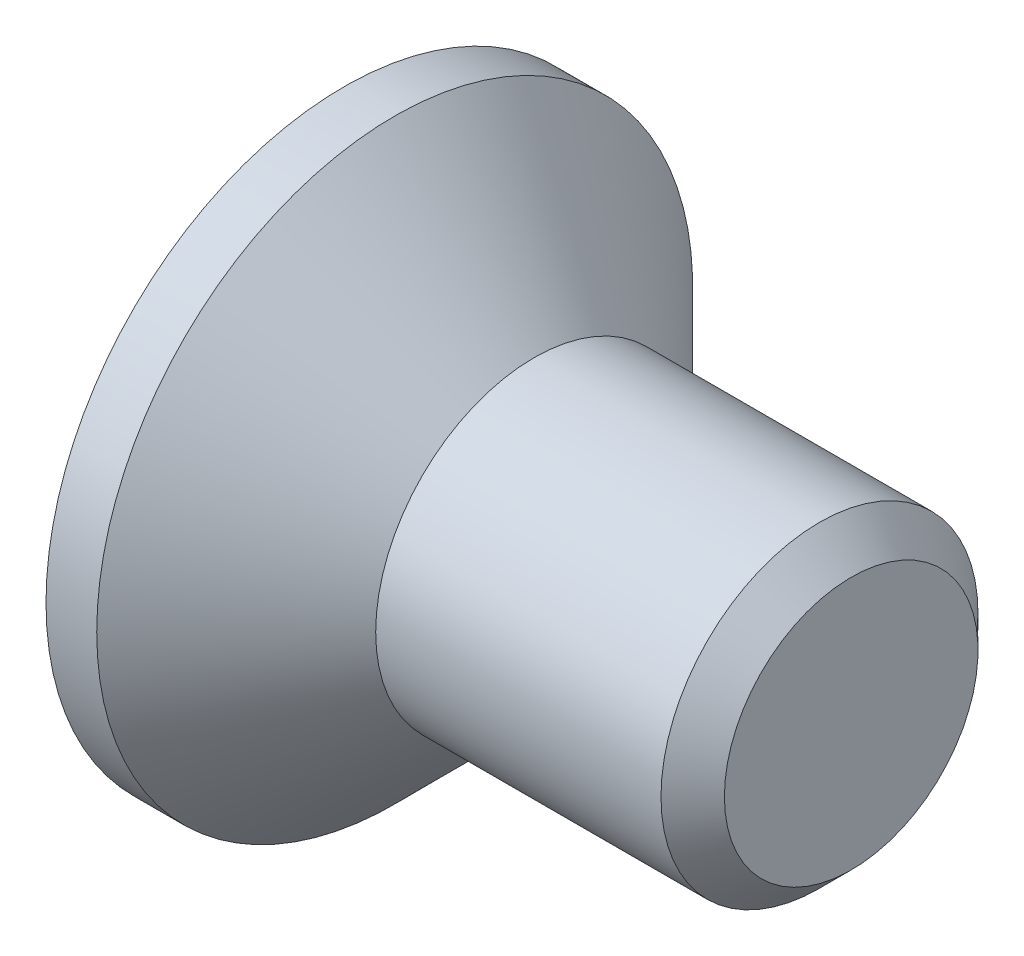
SolidWorks part; units mm, degrees
ref_plane "Front Plane" through (0, 0, 0) normal (0, 0, 1) x (1, 0, 0)
ref_plane "Top Plane" through (0, 0, 0) normal (0, 1, 0) x (1, 0, 0)
ref_plane "Right Plane" through (0, 0, 0) normal (1, 0, 0) x (0, 0, -1)
sketch "Sketch1" plane through (0, 0, 0) normal (0, 0, 1) x (1, 0, 0)
  line L1 (-1.5, 2.35) -> (-1.5, 0)
  line L2 (-1.5, 0) -> (2.5, 0)
  line L3 (2.5, 0) -> (2.5, 1.25)
  line L4 (2.5, 1.25) -> (0, 1.25)
  line L5 (-1.5, 2.35) -> (-1.1, 2.35)
  line L6 (-1.1, 2.35) -> (0, 1.25)
  dimension "D1" = 1.25
  dimension "D2" = 45
  dimension "D3" = 1.5
  dimension "D4" = 4
  dimension "D5" = 2.35
revolve "Revolve1" add sketch "Sketch1" angle 360 about L2
chamfer "Chamfer1" distance 0.25 angle 45 1 edges at (2.5, 0, 1.25)
sketch "Sketch2" plane through (-1.5, 0, 0) normal (-1, 0, 0) x (0, 0, 1)
  line L0 (-0.34, 1.35) -> (0.34, 1.35)
  line L1 (0.34, 1.35) -> (0.34, 0.34)
  line L2 (0.34, 0.34) -> (1.35, 0.34)
  line L3 (1.35, 0.34) -> (1.35, -0.34)
  line L4 (1.35, -0.34) -> (0.34, -0.34)
  line L5 (0.34, -0.34) -> (0.34, -1.35)
  line L6 (0.34, -1.35) -> (-0.34, -1.35)
  line L7 (-0.34, -1.35) -> (-0.34, -0.34)
  line L8 (-0.34, -0.34) -> (-1.35, -0.34)
  line L9 (-1.35, -0.34) -> (-1.35, 0.34)
  line L10 (-1.35, 0.34) -> (-0.34, 0.34)
  line L11 (-0.34, 0.34) -> (-0.34, 1.35)
  point P2 (0, 1.35)
  point P14 (0, -1.35)
  point P15 (1.35, 0)
  point P16 (-1.35, 0)
  dimension "D1" = 2.7
  dimension "D2" = 0.68
extrude "Cut-Extrude1" cut sketch "Sketch2" against normal blind 1.25
